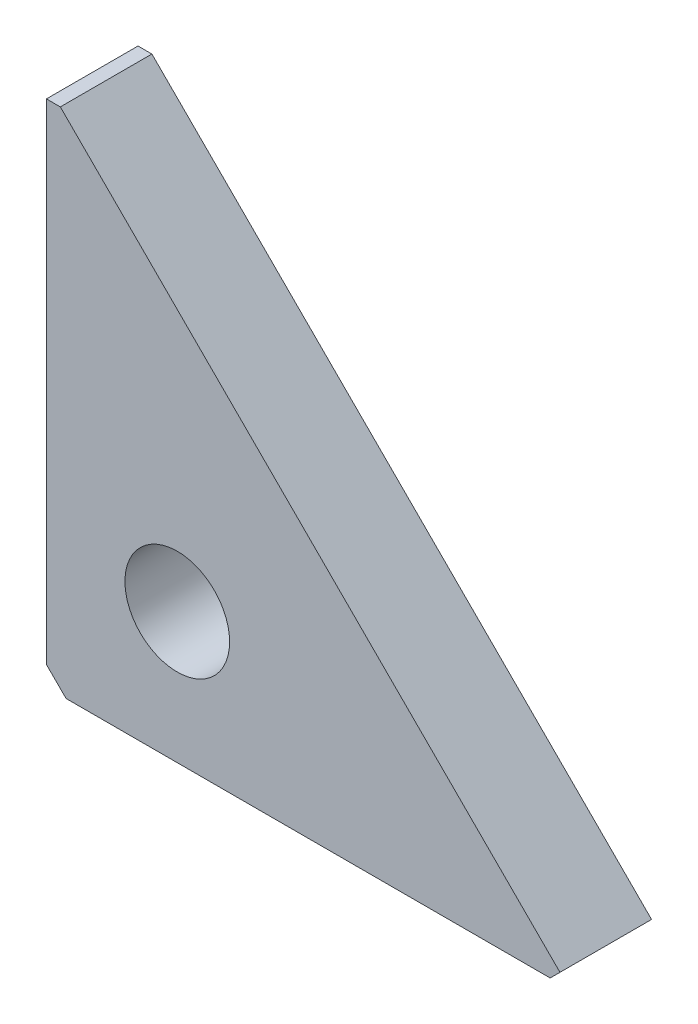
SolidWorks part; units mm, degrees
ref_plane "前基準面" through (0, 0, 0) normal (0, 0, 1) x (1, 0, 0)
ref_plane "上基準面" through (0, 0, 0) normal (0, 1, 0) x (1, 0, 0)
ref_plane "右基準面" through (0, 0, 0) normal (1, 0, 0) x (0, 0, -1)
sketch "草圖1" plane through (0, 0, 0) normal (0, 0, 1) x (1, 0, 0)
  line L0 (0, 0) -> (0, -80)
  line L1 (0, -80) -> (80, -80)
  line L2 (80, -80) -> (0, 0)
  dimension "D1" = 80
  dimension "D2" = 80
extrude "填料-伸長1" add sketch "草圖1" along normal blind 14
sketch "草圖2" plane through (0, 0, 14) normal (0, 0, 1) x (1, 0, 0)
  line L0 (0, -80) -> (40, -40) construction
  line L1 (80, -80) -> (0, 0) construction
  line L2 (0, -40) -> (40, -80) construction
  line L3 (0, 0) -> (0, -80) construction
  line L4 (0, -80) -> (80, -80) construction
chamfer "導角1" distance 3 angle 45 3 edges at (0, -80, 7) (80, -80, 7) (0, 0, 7)
sketch "草圖3" plane through (0, 0, 14) normal (0, 0, 1) x (1, 0, 0)
  line L0 (0, -2.1213) -> (0, -77) construction
  line L1 (3, -80) -> (77, -80) construction
  circle A0 centre (20, -60) radius 8
  dimension "D1" = 16
  dimension "D2" = 20
  dimension "D3" = 20
extrude "除料-伸長1" cut sketch "草圖3" against normal through all
